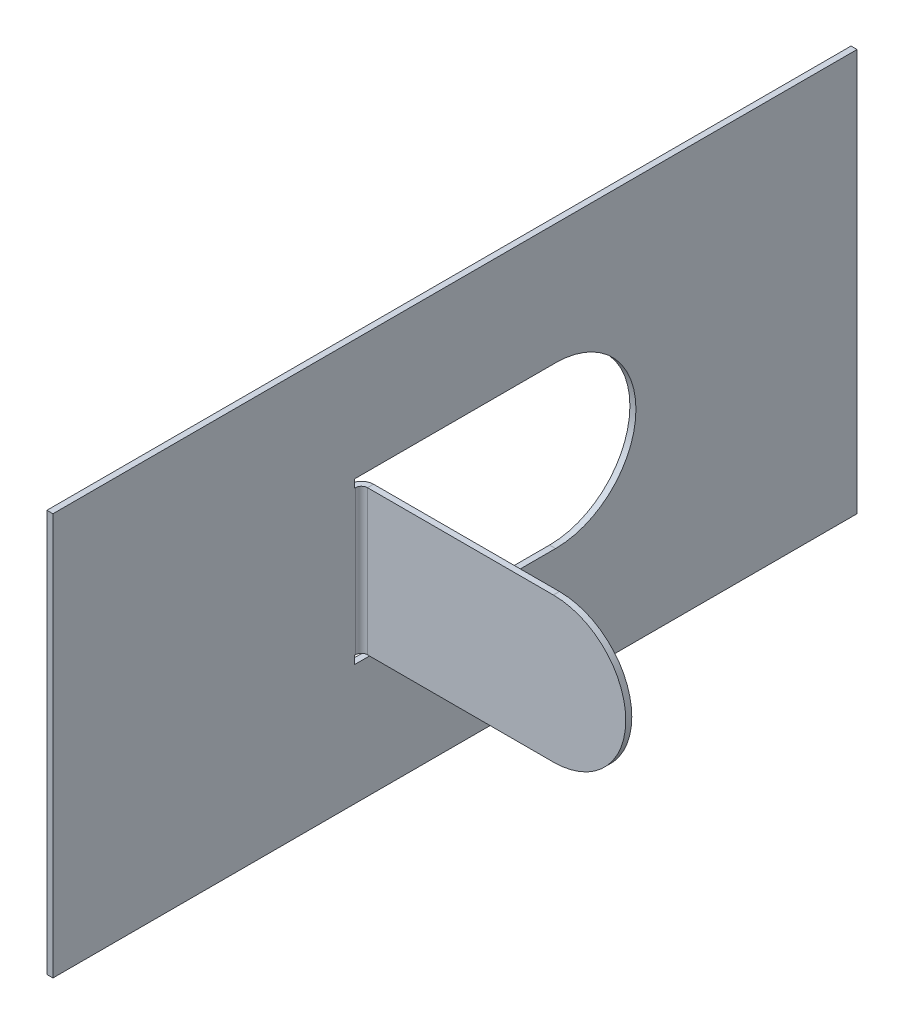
SolidWorks part; units mm, degrees
ref_plane "Ebene1" through (0, 0, 0) normal (0, 0, 1) x (1, 0, 0)
ref_plane "Ebene2" through (0, 0, 0) normal (0, 1, 0) x (1, 0, 0)
ref_plane "Ebene3" through (0, 0, 0) normal (1, 0, 0) x (0, 0, -1)
sketch "Skizze1" plane through (0, 0, 0) normal (0, 0, 1) x (1, 0, 0)
  line L1 (-100, 50) -> (100, 50)
  line L2 (-100, 50) -> (-100, -50)
  line L3 (-100, -50) -> (100, -50)
  line L4 (100, 50) -> (100, -50)
  line L5 (-100, 50) -> (100, -50) construction
  line L6 (-100, -50) -> (100, 50) construction
  dimension "D1" = 200
  dimension "D2" = 100
sheet metal parameters "Blech1" thickness 1.5 parameters "D1"=1.5, "Dicke"=1.5
base flange "Basis-Blech1" sketch "Skizze1" thickness 1.5 reverse thickness direction no parameters "D1"=1.5
sketch "Skizze3" plane through (0, 0, 0) normal (0, 0, 1) x (1, 0, 0)
  line L0 (-25, 0) -> (25, 0) construction
  line L1 (-25, 18) -> (25, 18)
  line L2 (-25, -18) -> (25, -18)
  line L3 (-25, 20) -> (25, 20)
  line L4 (-25, -20) -> (25, -20)
  line L5 (-25, 20) -> (-25, 18)
  line L6 (-25, -18) -> (-25, -20)
  line L7 (0, 18) -> (0, -18) construction
  arc A1 (25, -18) -> (25, 18) centre (25, 0) ccw
  arc A2 (25, -20) -> (25, 20) centre (25, 0) ccw
  arc A4 (-25, 20) -> (-25, -20) centre (-25, 0) ccw construction
  arc A5 (-25, 18) -> (-25, -18) centre (-25, 0) ccw construction
  point P2 (0, 0)
  dimension "D2" = 20
  dimension "D3" = 50
  dimension "D1" = 2
extrude "Schnitt-Linear austragen9" cut sketch "Skizze3" against normal through all
sketch "Skizze4" plane through (0, 0, 0) normal (0, 0, 1) x (1, 0, 0)
  line L0 (-23, 18) -> (-23, -18)
  line L1 (-25, 18) -> (25, 18) construction
  line L2 (25, -18) -> (-25, -18) construction
  line L3 (-25, 20) -> (-25, 18) construction
  dimension "D1" = 2
sketched bend "Skizzierte Biegung1" parameters "D1"=1.5
bend "Skizzenbiegung1" bend radius 1.5 bend angle 90 parameters "D5"=1
flat pattern "Abwicklung1"
sketch "Biegung-Linien1" plane through (0, 0, 0) normal (0, 1, 0) x (-1, 0, 0)
bend of the flat pattern "Abwickeln-<Skizzenbiegung1>1"
